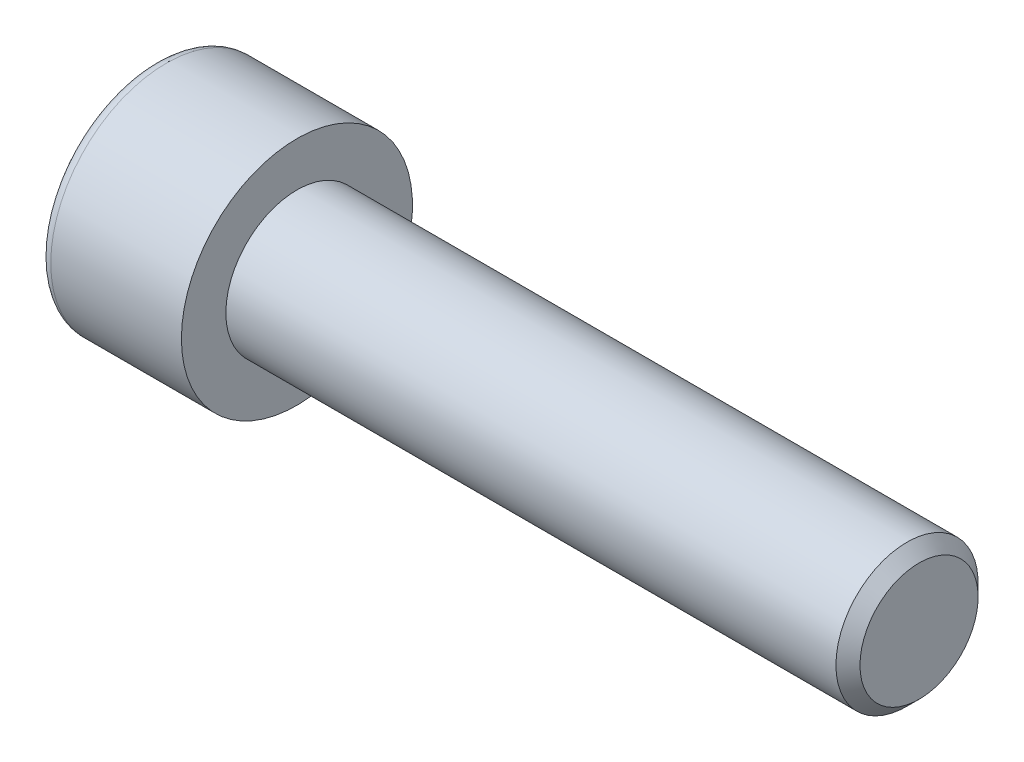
SolidWorks part; units mm, degrees
ref_plane "Front Plane" through (0, 0, 0) normal (0, 0, 1) x (1, 0, 0)
ref_plane "Top Plane" through (0, 0, 0) normal (0, 1, 0) x (1, 0, 0)
ref_plane "Right Plane" through (0, 0, 0) normal (1, 0, 0) x (0, 0, -1)
imported_body "07160-08x35"
sketch "Esquisse1" plane through (7, 0, 0) normal (-1, 0, 0) x (0, 0, 1)
  circle A0 centre (0, 0) radius 4 construction
  circle A1 centre (0, 0) radius 4
extrude "Boss.-Extru.1" add sketch "Esquisse1" along normal blind 2
